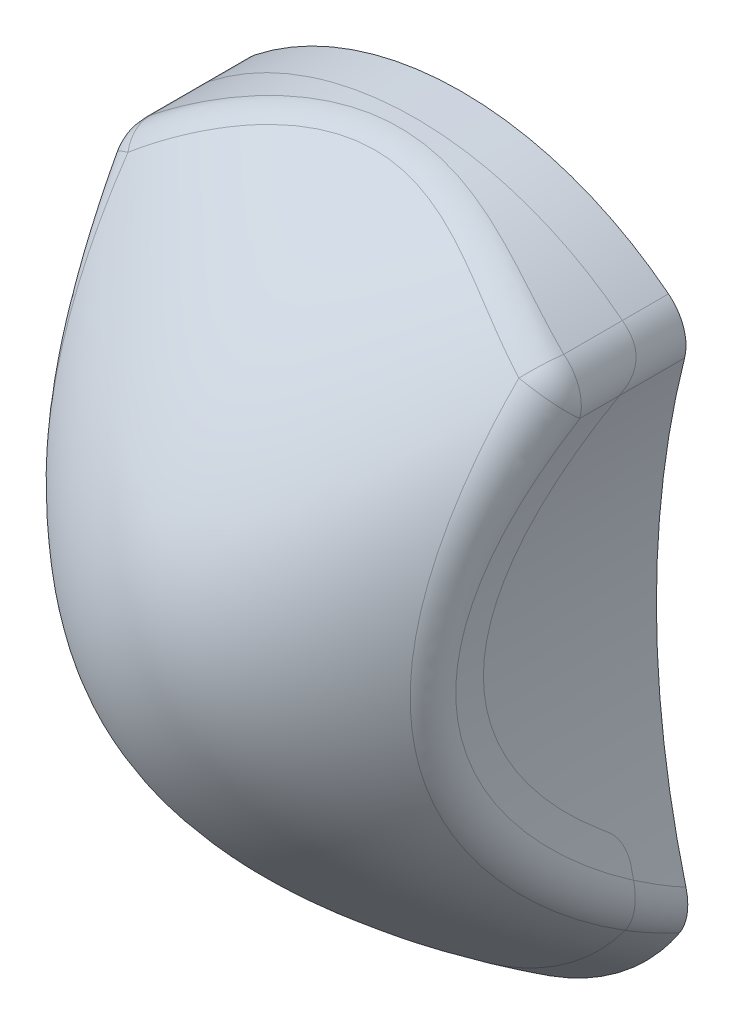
SolidWorks part; units mm, degrees
ref_plane "Płaszczyzna przednia" through (0, 0, 0) normal (0, 0, 1) x (1, 0, 0)
ref_plane "A" through (0, 0, 0) normal (0, 1, 0) x (1, 0, 0)
ref_plane "B" through (0, 0, 0) normal (1, 0, 0) x (0, 0, -1)
sketch "Szkic1" plane through (0, 0, 0) normal (0, 0, 1) x (1, 0, 0)
  line L0 (-25, 15) -> (25, 15) construction
  line L1 (-25, 80) -> (25, 80) construction
  line L2 (-25, 80) -> (-25, 0) construction
  line L3 (-25, 0) -> (25, 0) construction
  line L4 (25, 80) -> (25, 0) construction
  line L5 (-25, 70) -> (25, 70) construction
  arc A0 (-25, 15) -> (25, 15) centre (0, 28.3333) ccw
  arc A1 (-25, 70) -> (-25, 15) centre (-121.1444, 42.5) cw
  arc A2 (25, 70) -> (25, 15) centre (121.1444, 42.5) ccw
  arc A3 (-25, 70) -> (25, 70) centre (0, 43.75) cw
  dimension "D5" = 100
  dimension "D1" = 50
  dimension "D2" = 80
  dimension "D3" = 15
  dimension "D4" = 10
extrude "Dodanie-wyciągnięcie1" add sketch "Szkic1" along normal blind 60
ref_plane "C" through (-25, 0, 0) normal (1, 0, 0) x (0, 0, -1)
ref_plane "D" through (25, 0, 0) normal (1, 0, 0) x (0, 0, -1)
ref_plane "E" through (0, 80, 0) normal (0, 1, 0) x (1, 0, 0)
sketch "Szkic2" plane through (0, 80, 0) normal (0, 1, 0) x (1, 0, 0)
  line L0 (-25, -35.0108) -> (-25, 35.0108) construction
  line L1 (25, -33.5552) -> (25, 33.5552) construction
  line L2 (-25, 0) -> (25, 0) construction
  arc A0 (-25, -5) -> (25, -5) centre (0, 91.8246) ccw
  dimension "D1" = 100
  dimension "D2" = 5
sketch "Szkic3" plane through (0, 0, 0) normal (1, 0, 0) x (0, 0, -1)
  line L3 (0, 15) -> (0, 70) construction
  spline S0 degree 2 poles (-8.1754, 80) (-66.8799, 43.7358) (0, 0) knots 0 0 0 1 1 1
  dimension "D1" = 30
  dimension "D2" = 35
sketch "Szkic4" plane through (-25, 0, 0) normal (1, 0, 0) x (0, 0, -1)
  arc A0 (0, 15) -> (-5, 80) centre (20.6158, 49.2781) cw
  dimension "D1" = 40
sketch "Szkic5" plane through (25, 0, 0) normal (1, 0, 0) x (0, 0, -1)
  arc A0 (-5, 80) -> (0, 15) centre (20.6158, 49.2781) ccw construction
  arc A1 (-5, 80) -> (0, 15) centre (20.6158, 49.2781) ccw
surface "Powierzchnia-Wyciągnięcie po profilach1"
other "Cięcie powierzchnią1"
fillet "Zaokrąglenie1" radius 5 2 edges at (-25, 70, 6.8047) (25, 70, 6.8047)
fillet "Zaokrąglenie2" radius 5 7 edges at (-21.1653, 40.4591, 23.2497) (-0.448, 79.9972, 8.1789) (21.2905, 37.0977, 22.3017) (23.7755, 70.6252, 13.9786) (-24.1502, 69.7107, 14.3424)
shell "Skorupa1" thickness 2
sketch "Szkic6" plane through (0, 0, 0) normal (1, 0, 0) x (0, 0, -1)
  line L0 (-5, 0) -> (-5, 21.2908) construction
  line L1 (0, 80) -> (-6.7405, 80) construction
  line L2 (-5, 71.1546) -> (-5, 80) construction
  arc A0 (-5, 71.1546) -> (-6.63, 67.4609) centre (-10, 71.1546) cw construction
  arc A1 (-5, 21.2908) -> (-6.9115, 25.2228) centre (-10, 21.2908) ccw construction
  spline S1 degree 3 number of poles 78 (-5, 0) -> (-5, 80)
  spline S2 degree 3 poles (-2095.7083, 2197.0269) (481.1041, 4.3144) (47.3002, 146.7467) (-14.4872, 58.4764) (-15.119, 57.478) (-15.9793, 55.933) (-16.2518, 55.409) (-16.7581, 54.357) (-16.9927, 53.8276) (-17.4242, 52.7584) (-17.6205, 52.2202) (-17.9718, 51.1344) (-18.1271, 50.5856) (-18.3929, 49.481) (-18.5045, 48.9189) (-18.6772, 47.7986) (-18.7387, 47.2401) (-18.8484, 45.569) (-18.8217, 44.4581) (-18.6263, 42.7872) (-18.5346, 42.2262) (-18.3014, 41.1151) (-18.1603, 40.5657) (-17.6687, 38.9372) (-17.2506, 37.8785) (-16.4995, 36.3207) (-16.2282, 35.8063) (-15.6468, 34.7891) (-15.3397, 34.2917) (-14.3713, 32.8256) (-13.6664, 31.8882) (-12.151, 30.0762) (-11.3422, 29.2041) (-9.6345, 27.5227) (-8.7319, 26.7107) (-6.8714, 25.1705) (-5.9128, 24.441) (-3.9396, 23.0572) (-2.9282, 22.4052) (71.0609, -21.2041) (256.5532, 144.8441) (2303.198, 1941.2218) knots -5.490419 -5.490419 -5.490419 -5.490419 0.125 0.125 0.1875 0.1875 0.21875 0.21875 0.25 0.25 0.28125 0.28125 0.3125 0.3125 0.34375 0.34375 0.375 0.375 0.4375 0.4375 0.46875 0.46875 0.5 0.5 0.5625 0.5625 0.59375 0.59375 0.625 0.625 0.6875 0.6875 0.75 0.75 0.8125 0.8125 0.875 0.875 0.9375 0.9375 5.327999 5.327999 5.327999 5.327999 only from (-9.2096, 64.9647) to (1.2991, 20.088)
  spline S3 degree 3 poles (-6.63, 67.4609) (-9.3494, 64.9799) (-11.7828, 62.34) (-14.4872, 58.4764) (-15.119, 57.478) (-15.9793, 55.933) (-16.2518, 55.409) (-16.7581, 54.357) (-16.9927, 53.8276) (-17.4242, 52.7584) (-17.6205, 52.2202) (-17.9718, 51.1344) (-18.1271, 50.5856) (-18.3929, 49.481) (-18.5045, 48.9189) (-18.6772, 47.7986) (-18.7387, 47.2401) (-18.8484, 45.569) (-18.8217, 44.4581) (-18.6263, 42.7872) (-18.5346, 42.2262) (-18.3014, 41.1151) (-18.1603, 40.5657) (-17.6687, 38.9372) (-17.2506, 37.8785) (-16.4995, 36.3207) (-16.2282, 35.8063) (-15.6468, 34.7891) (-15.3397, 34.2917) (-14.3713, 32.8256) (-13.6664, 31.8882) (-12.151, 30.0762) (-11.3422, 29.2041) (-9.6345, 27.5227) (-8.7319, 26.7107) (-7.5077, 25.6973) (-7.211, 25.4581) (-6.9115, 25.2228) knots -0.061025 -0.061025 -0.061025 -0.061025 0.125 0.125 0.1875 0.1875 0.21875 0.21875 0.25 0.25 0.28125 0.28125 0.3125 0.3125 0.34375 0.34375 0.375 0.375 0.4375 0.4375 0.46875 0.46875 0.5 0.5 0.5625 0.5625 0.59375 0.59375 0.625 0.625 0.6875 0.6875 0.75 0.75 0.8125 0.8125 0.832246 0.832246 0.832246 0.832246 construction
  dimension "D3" = 5
  dimension "D2" = 5
  dimension "D1" = 3
split "Podziel1" trim tools "Szkic6" bodies to split 103 resulting bodies 106 107
